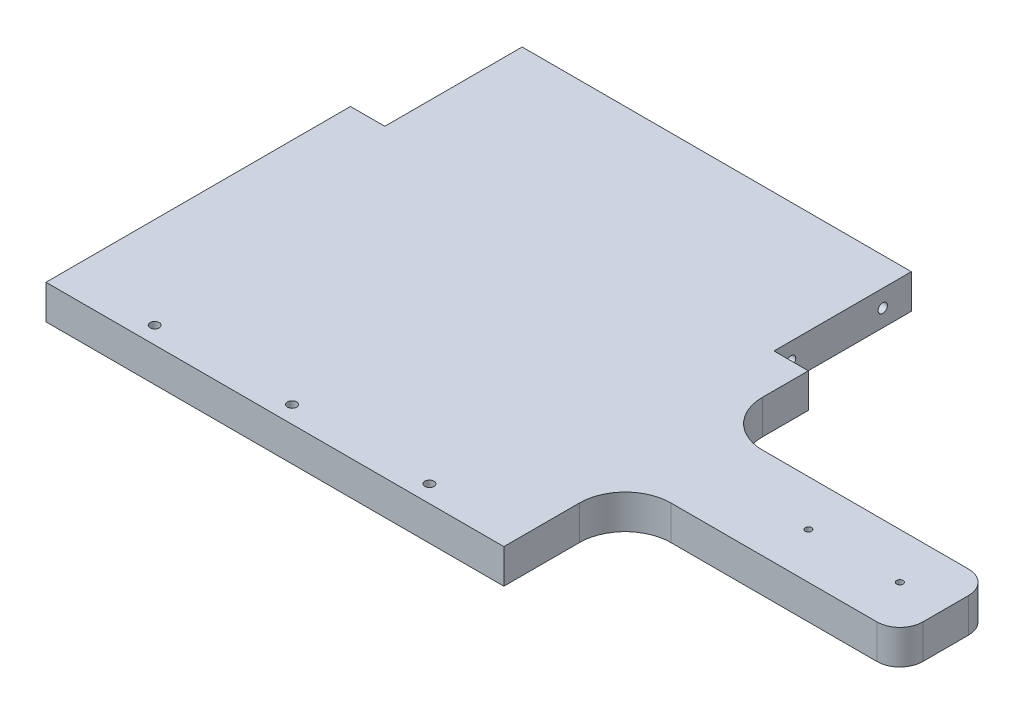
SolidWorks part; units mm, degrees
ref_plane "Front Plane" through (0, 0, 0) normal (0, 0, 1) x (1, 0, 0)
ref_plane "Top Plane" through (0, 0, 0) normal (0, 1, 0) x (1, 0, 0)
ref_plane "Right Plane" through (0, 0, 0) normal (1, 0, 0) x (0, 0, -1)
sketch "Sketch1" plane through (0, 0, 0) normal (0, 1, 0) x (1, 0, 0)
  line L0 (127, -122.555) -> (-127, -122.555)
  line L1 (127, -122.555) -> (127, 122.555)
  line L2 (-127, -122.555) -> (-127, 122.555)
  line L3 (127, 122.555) -> (-127, 122.555)
  line L4 (127, -122.555) -> (-127, 122.555) construction
  line L5 (-127, -122.555) -> (127, 122.555) construction
  line L6 (127, -4.445) -> (279.4, -4.445)
  line L7 (127, -4.445) -> (127, -55.245)
  line L8 (279.4, -4.445) -> (279.4, -55.245)
  line L9 (127, -55.245) -> (279.4, -55.245)
  point P1 (0, 0)
  dimension "D1" = 245.11
  dimension "D2" = 254
  dimension "D3" = 152.4
  dimension "D4" = 50.8
  dimension "D5" = 67.31
extrude "Boss-Extrude1" add sketch "Sketch1" along normal blind 19.05 contours L1 L3 L2 L0 | L1 L9 L8 L6
sketch "Sketch2" plane through (0, 19.05, 0) normal (0, 1, 0) x (1, 0, 0)
  line L0 (279.4, -4.445) -> (279.4, -55.245) construction
  line L1 (127, -55.245) -> (279.4, -55.245) construction
  circle A0 centre (203.2, -29.845) radius 1.778
  circle A1 centre (254, -29.845) radius 1.778
  dimension "D1" = 76.2
  dimension "D3" = 25.4
  dimension "D2" = 25.4
  dimension "D4" = 25.4
extrude "Cut-Extrude1" cut sketch "Sketch2" against normal through all
fillet "Fillet1" radius 25.4 1 edges at (127, 9.525, 4.445)
fillet "Fillet2" radius 25.4 1 edges at (127, 9.525, 55.245)
fillet "Fillet3" radius 12.7 1 edges at (279.4, 9.525, 4.445)
fillet "Fillet4" radius 12.7 1 edges at (279.4, 9.525, 55.245)
sketch "Sketch3" plane through (-127, 0, 0) normal (-1, 0, 0) x (0, 0, 1)
  line L0 (-122.555, 0) -> (-122.555, 19.05)
  line L1 (-122.555, 0) -> (-46.355, 0)
  line L2 (-122.555, 19.05) -> (-46.355, 19.05)
  line L3 (-46.355, 0) -> (-46.355, 19.05)
  dimension "D1" = 76.2
extrude "Cut-Extrude2" cut sketch "Sketch3" against normal blind 19.05
hole_wizard "#10 Clearance Hole1" positions "Sketch5" profile "Sketch4" hole size "#10" standard "ANSI Inch"
sketch "Sketch5" plane through (0, 19.05, 0) normal (0, 1, 0) x (1, 0, 0)
  line L0 (127, -122.555) -> (-127, -122.555) construction
  line L1 (-127, -122.555) -> (-127, 46.355) construction
  point P0 (-76.2, -113.03)
  dimension "D1" = 9.525
  dimension "D2" = 50.8
sketch "Sketch4" plane through (-76.2, 19.05, 113.03) normal (1, 0, 0) x (0, 0, 1)
  line L0 (0, 0) -> (0, 19.05)
  line L1 (0, 19.05) -> (2.5527, 19.05)
  line L2 (2.5527, 19.05) -> (2.5527, 0)
  line L5 (2.5527, 0) -> (0, 0)
  line L11 (0, -6.35) -> (0, 107.95) construction
  dimension "Thru Hole Dia." = 5.1054
  dimension "Thru Hole Depth" = 19.05
mirror "Mirror1" about plane through (0, 0, 0) normal (1, 0, 0) of "#10 Clearance Hole1"
hole_wizard "#10 Clearance Hole2" positions "Sketch7" profile "Sketch6" hole size "#10" standard "ANSI Inch"
sketch "Sketch7" plane through (0, 19.05, 0) normal (0, 1, 0) x (1, 0, 0)
  line L0 (127, -122.555) -> (-127, -122.555) construction
  point P0 (0, -113.03)
  point P3 (0, -122.555)
  dimension "D1" = 9.525
sketch "Sketch6" plane through (0, 19.05, 113.03) normal (1, 0, 0) x (0, 0, 1)
  line L0 (0, 0) -> (0, 19.05)
  line L1 (0, 19.05) -> (2.5527, 19.05)
  line L2 (2.5527, 19.05) -> (2.5527, 0)
  line L5 (2.5527, 0) -> (0, 0)
  line L11 (0, -6.35) -> (0, 107.95) construction
  dimension "Thru Hole Dia." = 5.1054
  dimension "Thru Hole Depth" = 19.05
sketch "Sketch8" plane through (127, 0, 0) normal (1, 0, 0) x (0, 0, -1)
  line L0 (122.555, 19.05) -> (122.555, 0)
  line L1 (122.555, 19.05) -> (46.355, 19.05)
  line L2 (122.555, 0) -> (46.355, 0)
  line L3 (46.355, 19.05) -> (46.355, 0)
  dimension "D1" = 76.2
extrude "Cut-Extrude3" cut sketch "Sketch8" against normal blind 19.05
hole_wizard "#7 (0.201) Diameter Hole1" positions "Sketch10" profile "Sketch9" hole size "#7" standard "ANSI Inch"
sketch "Sketch10" plane through (107.95, 0, 0) normal (1, 0, 0) x (0, 0, -1)
  line L0 (46.355, 0) -> (122.555, 0) construction
  line L1 (46.355, 19.05) -> (46.355, 0) construction
  point P0 (55.88, 9.525)
  dimension "D1" = 9.525
  dimension "D2" = 9.525
sketch "Sketch9" plane through (107.95, 9.525, -55.88) normal (0, 1, 0) x (0, 0, -1)
  line L0 (0, 0) -> (0, 52.3338)
  line L1 (0, 52.3338) -> (2.5527, 50.8)
  line L2 (2.5527, 50.8) -> (2.5527, 0)
  line L5 (2.5527, 0) -> (0, 0)
  line L10 (0, 52.3338) -> (-2.5527, 50.8) construction
  line L11 (0, -6.35) -> (0, 107.95) construction
  dimension "Hole Dia." = 5.1054
  dimension "Hole Depth" = 50.8
  dimension "Drill Angle" = 118
hole_wizard "#7 (0.201) Diameter Hole2" positions "Sketch12" profile "Sketch11" hole size "#7" standard "ANSI Inch"
sketch "Sketch12" plane through (107.95, 0, 0) normal (1, 0, 0) x (0, 0, -1)
  line L0 (46.355, 0) -> (122.555, 0) construction
  circle A0 centre (55.88, 9.525) radius 2.5527 construction
  point P0 (106.68, 9.525)
  dimension "D1" = 9.525
  dimension "D2" = 50.8
sketch "Sketch11" plane through (107.95, 9.525, -106.68) normal (0, 1, 0) x (0, 0, -1)
  line L0 (0, 0) -> (0, 52.3338)
  line L1 (0, 52.3338) -> (2.5527, 50.8)
  line L2 (2.5527, 50.8) -> (2.5527, 0)
  line L5 (2.5527, 0) -> (0, 0)
  line L10 (0, 52.3338) -> (-2.5527, 50.8) construction
  line L11 (0, -6.35) -> (0, 107.95) construction
  dimension "Hole Dia." = 5.1054
  dimension "Hole Depth" = 50.8
  dimension "Drill Angle" = 118
mirror "Mirror2" about plane through (0, 0, 0) normal (1, 0, 0) of "#7 (0.201) Diameter Hole2", "#7 (0.201) Diameter Hole1"
hole_wizard "#7 (0.201) Diameter Hole3" positions "Sketch14" profile "Sketch13" hole size "#7" standard "ANSI Inch"
sketch "Sketch14" plane through (0, 0, -122.555) normal (0, 0, -1) x (-1, 0, 0)
  line L0 (107.95, 19.05) -> (107.95, 0) construction
  line L1 (-107.95, 19.05) -> (107.95, 19.05) construction
  point P0 (63.5, 9.525)
  dimension "D1" = 44.45
  dimension "D2" = 9.525
sketch "Sketch13" plane through (-63.5, 9.525, -122.555) normal (1, 0, 0) x (0, 1, 0)
  line L0 (0, 0) -> (0, 52.3338)
  line L1 (0, 52.3338) -> (2.5527, 50.8)
  line L2 (2.5527, 50.8) -> (2.5527, 0)
  line L5 (2.5527, 0) -> (0, 0)
  line L10 (0, 52.3338) -> (-2.5527, 50.8) construction
  line L11 (0, -6.35) -> (0, 107.95) construction
  dimension "Hole Dia." = 5.1054
  dimension "Hole Depth" = 50.8
  dimension "Drill Angle" = 118
mirror "Mirror3" about plane through (0, 0, 0) normal (1, 0, 0) of "#7 (0.201) Diameter Hole3"
hole_wizard "#7 (0.201) Diameter Hole5" positions "Sketch16" profile "Sketch15" hole size "#7" standard "ANSI Inch"
sketch "Sketch16" plane through (0, 0, -122.555) normal (0, 0, -1) x (-1, 0, 0)
  line L0 (-107.95, 19.05) -> (107.95, 19.05) construction
  point P0 (0, 9.525)
  point P3 (0, 19.05)
  dimension "D1" = 9.525
sketch "Sketch15" plane through (0, 9.525, -122.555) normal (1, 0, 0) x (0, 1, 0)
  line L0 (0, 0) -> (0, 52.3338)
  line L1 (0, 52.3338) -> (2.5527, 50.8)
  line L2 (2.5527, 50.8) -> (2.5527, 0)
  line L5 (2.5527, 0) -> (0, 0)
  line L10 (0, 52.3338) -> (-2.5527, 50.8) construction
  line L11 (0, -6.35) -> (0, 107.95) construction
  dimension "Hole Dia." = 5.1054
  dimension "Hole Depth" = 50.8
  dimension "Drill Angle" = 118
